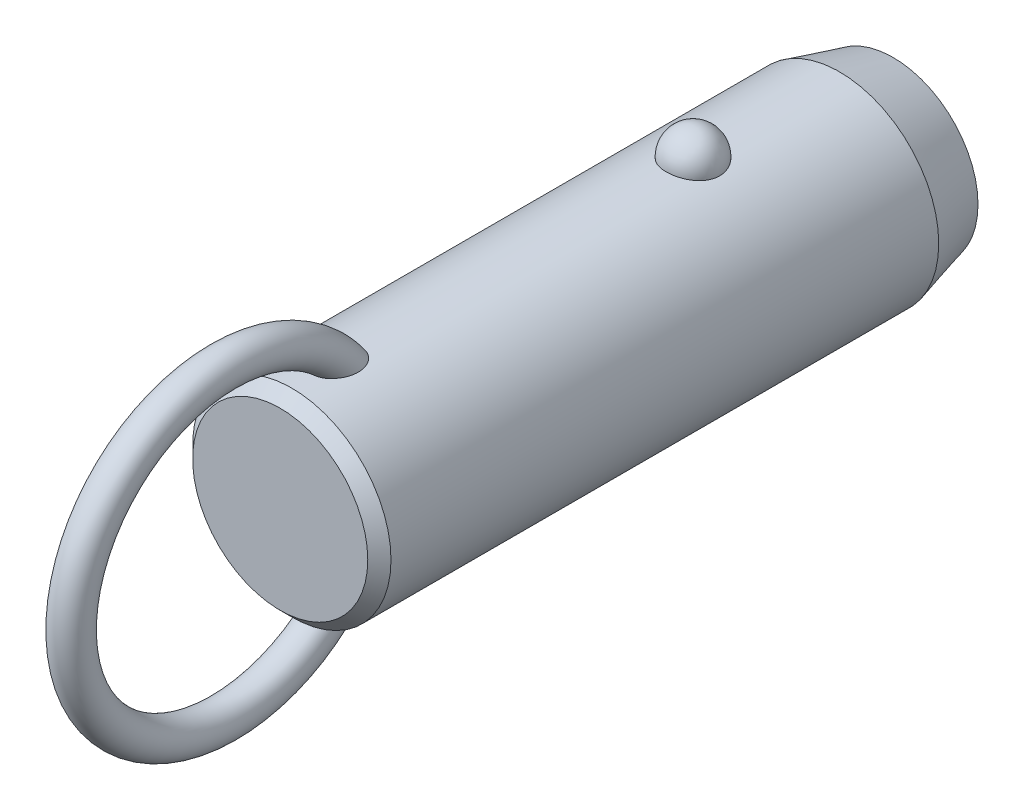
SolidWorks part; units mm, degrees
ref_plane "Front Plane" through (0, 0, 0) normal (0, 0, 1) x (1, 0, 0)
ref_plane "Top Plane" through (0, 0, 0) normal (0, 1, 0) x (1, 0, 0)
ref_plane "Right Plane" through (0, 0, 0) normal (1, 0, 0) x (0, 0, -1)
sketch "Sketch2" plane through (0, 0, 0) normal (0, 0, 1) x (1, 0, 0)
  circle A0 centre (0, 0) radius 11.1
  point P3 (0, 11.1)
  dimension "D1" = 22.2
extrude "Boss-Extrude1" add sketch "Sketch2" along normal blind 30.5
sketch "Sketch3" plane through (0, 0, 0) normal (0, 0, -1) x (-1, 0, 0)
  circle A0 centre (0, 0) radius 11.1
  dimension "D1" = 22.2
extrude "Boss-Extrude2" add sketch "Sketch3" along normal blind 25.4
chamfer "Chamfer1" distance 6 angle 15 1 edges at (-11.1, 0, -25.4)
sketch "Sketch12" plane through (0, 0, 0) normal (1, 0, 0) x (0, 0, -1)
  line L0 (-30.5, 11.1) -> (-30.5, -11.1) construction
  point P0 (-30.5, 0)
sketch "Sketch13" plane through (0, 0, 0) normal (1, 0, 0) x (0, 0, -1)
  circle A0 centre (-49.55, 0) radius 19.05
  point P2 (-30.5, 0)
  dimension "D1" = 38.1
sketch "Sketch14" plane through (0, 0, 0) normal (0, 1, 0) x (1, 0, 0)
  circle A0 centre (0, -32.5) radius 2
  point P2 (0, -30.5)
  dimension "D1" = 4
sweep "Sweep1" add profiles "Sketch14" path "Sketch13"
sketch "Sketch15" plane through (0, 0, 30.5) normal (0, 0, 1) x (1, 0, 0)
  circle A0 centre (0, 0) radius 11.1
  dimension "D1" = 22.2
extrude "Boss-Extrude3" add sketch "Sketch15" along normal blind 12.7
chamfer "Chamfer2" distance 1.3 angle 45 1 edges at (11.1, 0, 43.2)
sketch "Sketch18" plane through (0, 0, 0) normal (1, 0, 0) x (0, 0, -1)
  line L0 (19.4, 11.1) -> (-34.068, 11.1) construction
  line L1 (3, 14.1) -> (3, 8.1)
  line L2 (-34.068, -11.1) -> (19.4, -11.1) construction
  arc A0 (3, 14.1) -> (3, 8.1) centre (3, 11.1) ccw
  point P4 (0, 11.1)
  dimension "D1" = 25.2
revolve "Revolve1" add sketch "Sketch18" angle 360 about L1
